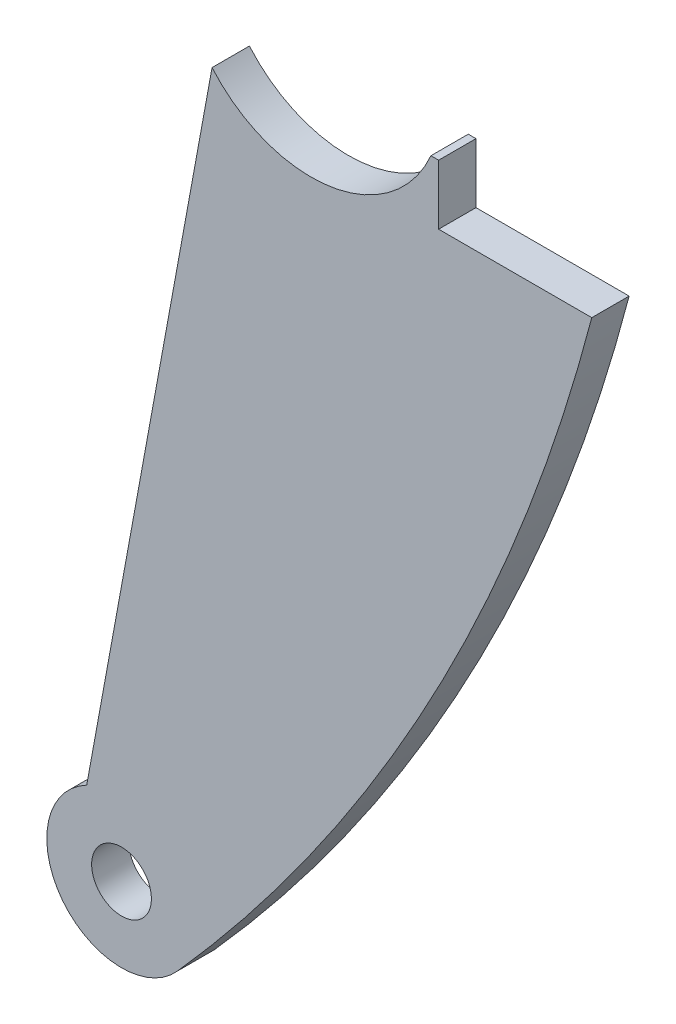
SolidWorks part; units mm, degrees
ref_plane "Face" through (0, 0, 0) normal (0, 0, 1) x (1, 0, 0)
ref_plane "Dessus" through (0, 0, 0) normal (0, 1, 0) x (1, 0, 0)
ref_plane "Droite" through (0, 0, 0) normal (1, 0, 0) x (0, 0, -1)
sketch "Esquisse1" plane through (0, 0, 0) normal (0, 0, 1) x (1, 0, 0)
  line L0 (0, 0) -> (0, -60.381) construction
  line L1 (-13.254, -11.4272) -> (-30.029, -102.9852)
  line L2 (17.0707, -7) -> (16.039, -7)
  line L3 (-13.254, -11.4272) -> (-10.2029, 2.2724) construction
  line L4 (0, 0) -> (-10.2029, 2.2724) construction
  line L5 (0, 0) -> (-25.3714, -111.8343) construction
  line L7 (37.5707, -15) -> (17.0707, -15)
  line L8 (17.0707, -7) -> (17.0707, -15)
  arc A0 (-17.9143, -118.4969) -> (-30.029, -102.9852) centre (-25.3714, -111.8343) cw
  arc A1 (-13.254, -11.4272) -> (16.039, -7) centre (0, 0) ccw
  circle A2 centre (-25.3714, -111.8343) radius 4
  arc A3 (-17.9143, -118.4969) -> (37.5707, -15) centre (-204.343, 48.0694) ccw
  dimension "D1" = 10
  dimension "D2" = 17.5
  dimension "D3" = 8
  dimension "D13" = 114.6761
  dimension "D12" = 12.782
  dimension "D10" = 500
  dimension "D4" = 15
  dimension "D5" = 204.343
  dimension "D6" = 48.0694
  dimension "D8" = 20.5
  dimension "D9" = 6.5
  dimension "D11" = 8
  dimension "D14" = 13.254
extrude "Extrusion1" add sketch "Esquisse1" along normal mid plane 5
